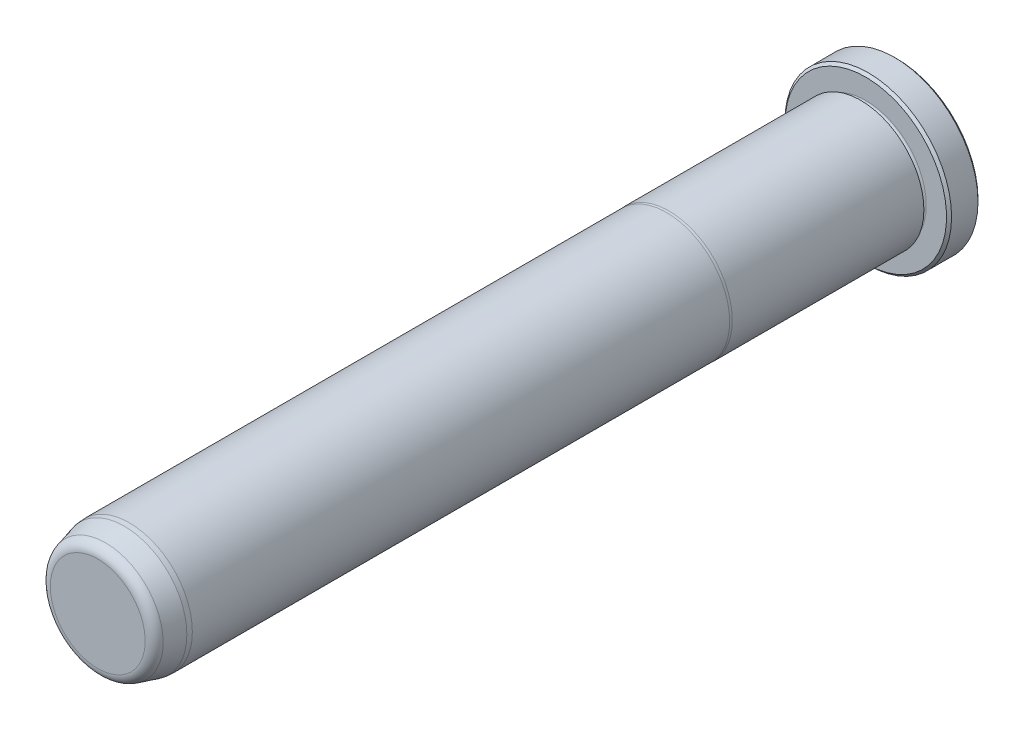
SolidWorks part; units mm, degrees
ref_plane "Front Plane" through (0, 0, 0) normal (0, 0, 1) x (1, 0, 0)
ref_plane "Top Plane" through (0, 0, 0) normal (0, 1, 0) x (1, 0, 0)
ref_plane "Right Plane" through (0, 0, 0) normal (1, 0, 0) x (0, 0, -1)
sketch "Sketch1" plane through (0, 0, 0) normal (1, 0, 0) x (0, 0, -1)
  line L0 (0, 0) -> (0, 12.573)
  line L1 (0, 12.573) -> (-4.7498, 12.573)
  line L2 (-4.7498, 12.573) -> (-4.7498, 9.1313)
  line L3 (-4.7498, 8.7503) -> (-5.5118, 8.7503) construction
  line L4 (-5.5118, 9.1313) -> (-5.5118, 9.5377)
  line L5 (-5.5118, 9.5377) -> (-34.4348, 9.5377)
  line L6 (-34.4348, 9.5377) -> (-34.798, 9.5123)
  line L7 (-34.798, 9.5123) -> (-115.8875, 9.5123)
  line L9 (-120.65, 8.3737) -> (-120.65, 0)
  line L10 (-120.65, 0) -> (0, 0)
  line L11 (0, 0) -> (13.6287, 0) construction
  line L12 (-115.8875, 9.5123) -> (-116.6495, 9.4456)
  line L13 (-116.6495, 9.4456) -> (-120.65, 8.3737)
  arc A0 (-5.5118, 9.1313) -> (-4.7498, 9.1313) centre (-5.1308, 9.1313) ccw
  dimension "D14" = 0.762
  dimension "D1" = 4.7498
  dimension "D2" = 0.762
  dimension "D3" = 25.146
  dimension "D4" = 19.0754
  dimension "D5" = 34.798
  dimension "D6" = 120.65
  dimension "D7" = 0.7874
  dimension "D8" = 4
  dimension "D9" = 19.0246
  dimension "D10" = 5
  dimension "D11" = 15
  dimension "D12" = 0.762
  dimension "D13" = 4.7625
revolve "Revolve1" add sketch "Sketch1" angle 360 about L11
fillet "Fillet6" radius 1.5875 1 edges at (8.3737, 0, 120.65)
chamfer "Chamfer1" distance 0.381 angle 45 2 edges at (12.573, 0, 0) (12.573, 0, 4.7498)
